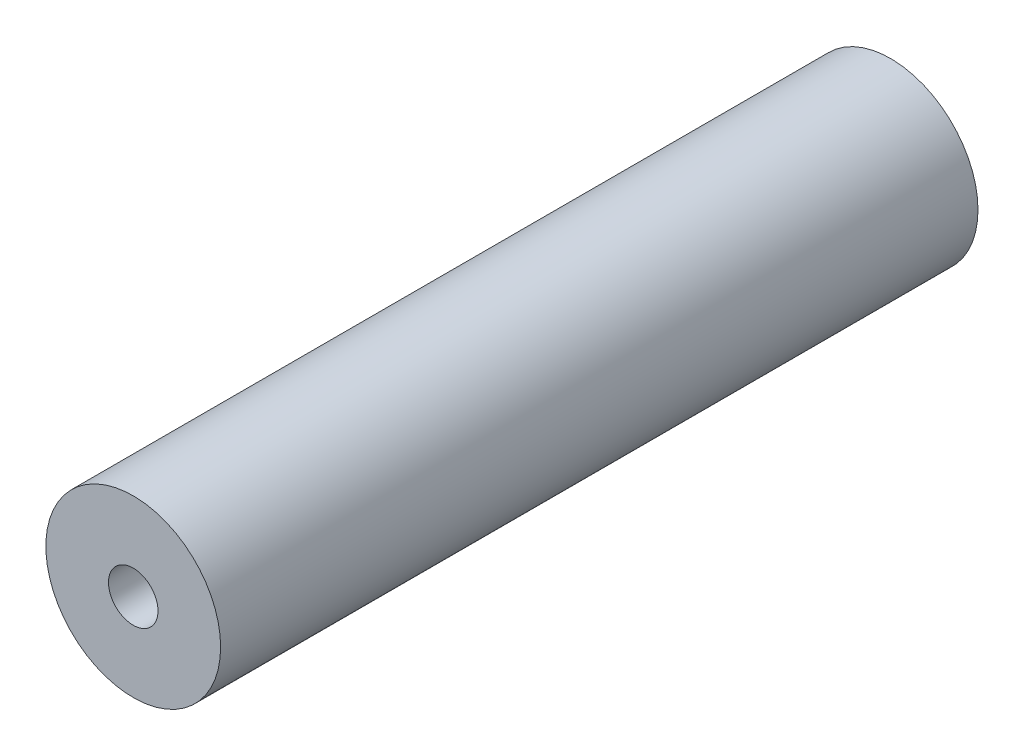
SolidWorks part; units mm, degrees
ref_plane "Plan de face" through (0, 0, 0) normal (0, 0, 1) x (1, 0, 0)
ref_plane "Plan de dessus" through (0, 0, 0) normal (0, 1, 0) x (1, 0, 0)
ref_plane "Plan de droite" through (0, 0, 0) normal (1, 0, 0) x (0, 0, -1)
sketch "Esquisse1" plane through (0, 0, 0) normal (0, 0, 1) x (1, 0, 0)
  circle A0 centre (0, 0) radius 15
  dimension "D1" = 30
extrude "Extrusion1" add sketch "Esquisse1" along normal blind 130
hole_wizard "Trou taraudé M10x1.51" positions "Esquisse3" profile "Esquisse2" tap size "M10x1.5" standard "ISO"
sketch "Esquisse3" plane through (0, 0, 130) normal (0, 0, 1) x (1, 0, 0)
  point P0 (0, 0)
sketch "Esquisse2" plane through (0, 0, 130) normal (1, 0, 0) x (0, -1, 0)
  line L0 (0, 0) -> (0, 32.0537)
  line L1 (0, 32.0537) -> (4.25, 29.5)
  line L2 (4.25, 29.5) -> (4.25, 0)
  line L5 (4.25, 0) -> (0, 0)
  line L10 (0, 32.0537) -> (-4.25, 29.5) construction
  line L11 (0, -6.35) -> (0, 107.95) construction
  dimension "Diamètre du trou pour taraudage" = 8.5
  dimension "Profondeur du trou pour taraudage" = 29.5
  dimension "Angle de pointe" = 118
hole_wizard "Trou taraudé M10x1.52" positions "Esquisse5" profile "Esquisse4" tap size "M10x1.5" standard "ISO"
sketch "Esquisse5" plane through (0, 0, 0) normal (0, 0, -1) x (-1, 0, 0)
  point P0 (0, 0)
sketch "Esquisse4" plane through (0, 0, 0) normal (1, 0, 0) x (0, 1, 0)
  line L0 (0, 0) -> (0, 32.0537)
  line L1 (0, 32.0537) -> (4.25, 29.5)
  line L2 (4.25, 29.5) -> (4.25, 0)
  line L5 (4.25, 0) -> (0, 0)
  line L10 (0, 32.0537) -> (-4.25, 29.5) construction
  line L11 (0, -6.35) -> (0, 107.95) construction
  dimension "Diamètre du trou pour taraudage" = 8.5
  dimension "Profondeur du trou pour taraudage" = 29.5
  dimension "Angle de pointe" = 118
